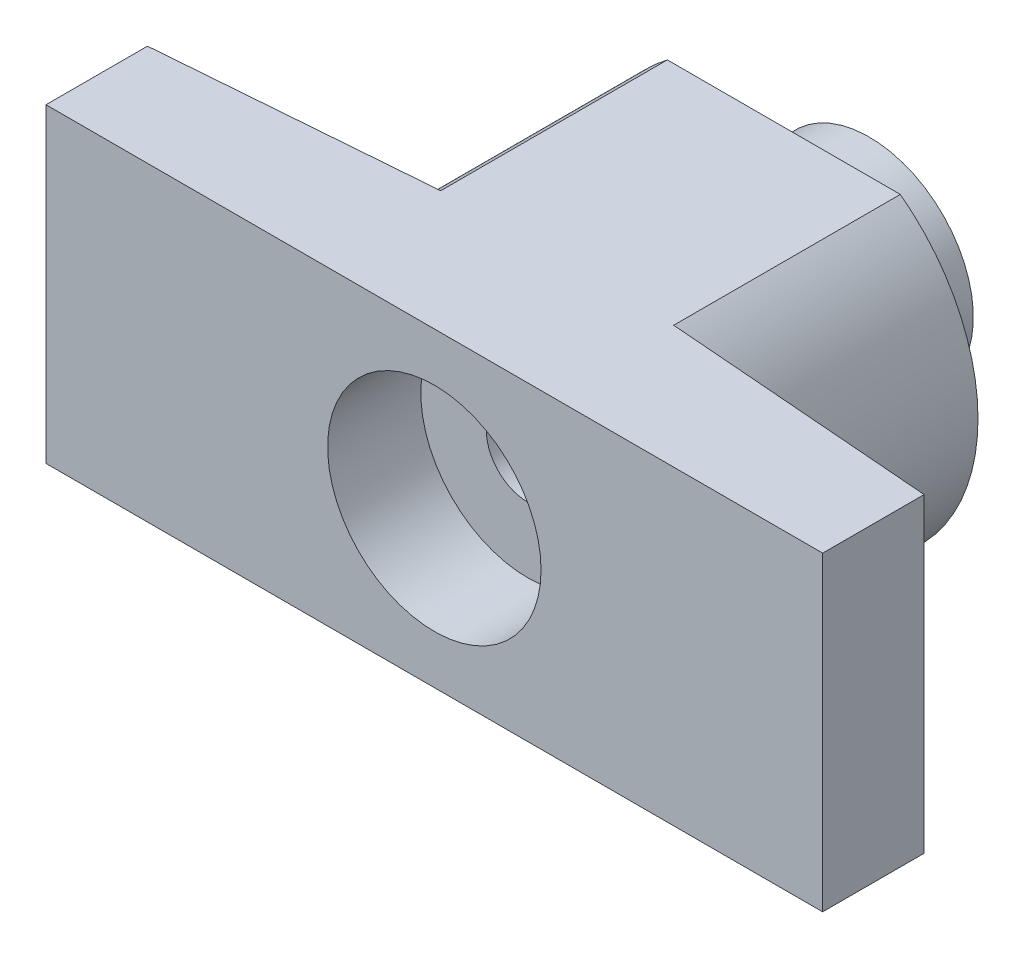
SolidWorks part; units mm, degrees
ref_plane "Plane1" through (0, 0, 0) normal (0, 0, 1) x (1, 0, 0)
ref_plane "Plane2" through (0, 0, 0) normal (0, 1, 0) x (1, 0, 0)
ref_plane "Plane3" through (0, 0, 0) normal (1, 0, 0) x (0, 0, -1)
sketch "Sketch1" plane through (0, 0, 0) normal (0, 0, 1) x (1, 0, 0)
  line L0 (-31.75, 12.7) -> (31.75, 12.7)
  line L1 (-31.75, 12.7) -> (-31.75, -12.7)
  line L2 (31.75, -12.7) -> (-31.75, -12.7)
  line L3 (31.75, -12.7) -> (31.75, 12.7)
  dimension "D1" = 12.7
  dimension "D2" = 25.4
  dimension "D3" = 63.5
  dimension "D4" = 31.75
extrude "Base-Extrude" add sketch "Sketch1" along normal blind 10.795
sketch "Sketch4" plane through (0, -12.7, 0) normal (0, -1, 0) x (1, 0, 0)
  line L0 (0, 0) -> (35.3937, 2.7855)
  line L1 (0, 0) -> (0, 17.957) construction
  line L2 (31.75, 0) -> (-31.75, 0) construction
  line L3 (0, 0) -> (-35.3937, 2.7855)
  line L4 (35.3937, 2.7855) -> (35.3937, -2.3683)
  line L5 (35.3937, -2.3683) -> (-35.3937, -2.3683)
  line L6 (-35.3937, -2.3683) -> (-35.3937, 2.7855)
  dimension "D1" = 4.5
extrude "Cut-Extrude3" cut sketch "Sketch4" against normal through all
sketch "Sketch5" plane through (0, 0, 10.795) normal (0, 0, 1) x (1, 0, 0)
  line L0 (-9.525, 12.7) -> (9.525, 12.7)
  line L1 (-9.525, -12.7) -> (9.525, -12.7)
  line L2 (31.75, -12.7) -> (-31.75, -12.7) construction
  arc A0 (9.525, -12.7) -> (9.525, 12.7) centre (0, 0) ccw
  arc A1 (-9.525, 12.7) -> (-9.525, -12.7) centre (0, 0) ccw
  dimension "D1" = 31.75
extrude "Boss-Extrude1" add sketch "Sketch5" against normal blind 28.575
sketch "Sketch6" plane through (0, 0, -17.78) normal (0, 0, -1) x (-1, 0, 0)
  circle A0 centre (0, 0) radius 8.509
  dimension "D1" = 17.018
extrude "Boss-Extrude2" add sketch "Sketch6" along normal blind 6.985
sketch "Sketch7" plane through (0, 0, -24.765) normal (0, 0, -1) x (-1, 0, 0)
  circle A0 centre (0, 0) radius 3.3655
  dimension "D1" = 6.731
extrude "Cut-Extrude4" cut sketch "Sketch7" against normal through all
sketch "Sketch8" plane through (0, 0, 10.795) normal (0, 0, 1) x (1, 0, 0)
  circle A0 centre (0, 0) radius 8.7249
  dimension "D1" = 17.4498
extrude "Cut-Extrude5" cut sketch "Sketch8" against normal blind 7.62
